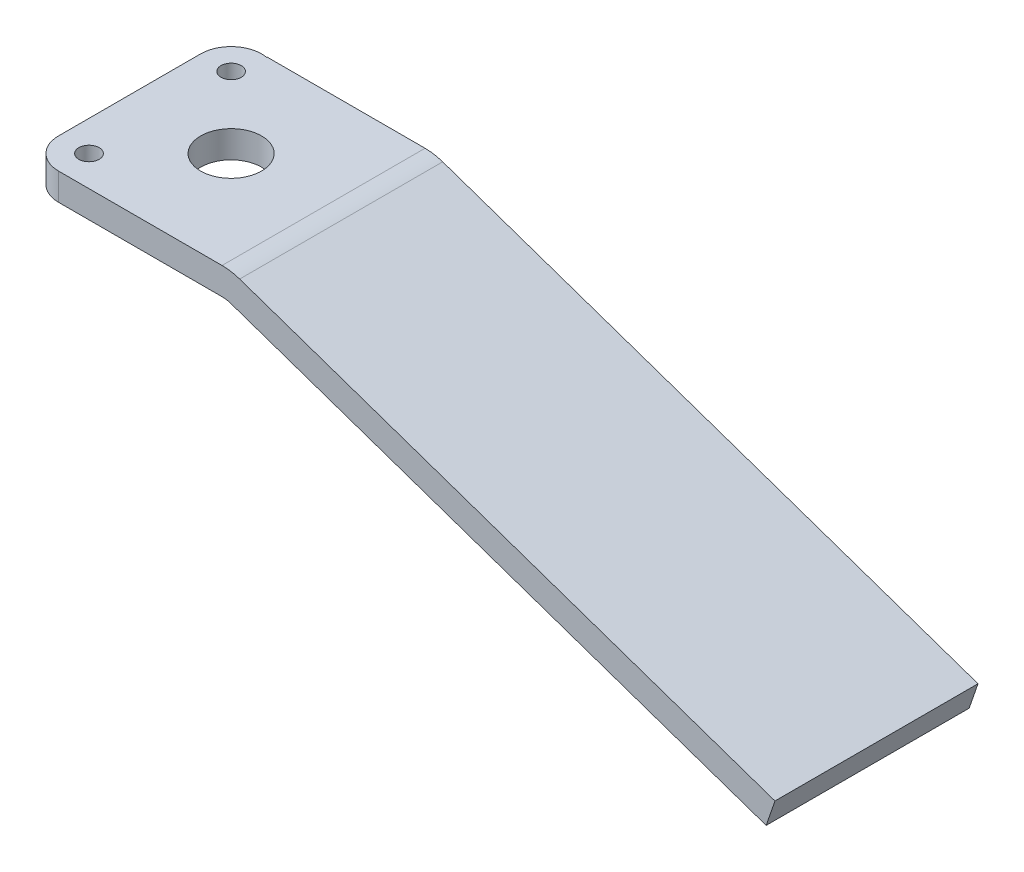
SolidWorks part; units mm, degrees
ref_plane "Plan1" through (0, 0, 0) normal (0, 0, 1) x (1, 0, 0)
ref_plane "Plan2" through (0, 0, 0) normal (0, 1, 0) x (1, 0, 0)
ref_plane "Plan3" through (0, 0, 0) normal (1, 0, 0) x (0, 0, -1)
sketch "Esquisse1" plane through (0, 0, 0) normal (0, 0, 1) x (1, 0, 0)
  line L0 (-14.3306, 0) -> (14.3306, 0)
  line L1 (-14.3306, 0) -> (-14.3306, -4)
  line L2 (14.3306, -4) -> (-14.3306, -4)
  line L4 (15.6329, -4.2179) -> (94.7362, -31.4554)
  line L5 (16.9352, -0.4359) -> (84.9309, -23.8487)
  line L6 (84.9309, -23.8487) -> (96.0384, -27.6733)
  line L7 (96.0384, -27.6733) -> (94.7362, -31.4554)
  arc A0 (15.6329, -4.2179) -> (14.3306, -4) centre (14.3306, -8) ccw
  arc A1 (16.9352, -0.4359) -> (14.3306, 0) centre (14.3306, -8) ccw
  point P12 (15.6694, 0)
  dimension "D4" = 4
  dimension "D5" = 8
  dimension "D1" = 30
  dimension "D2" = 85
  dimension "D3" = 4
  dimension "D6" = 161
extrude "Base-Extrusion" add sketch "Esquisse1" along normal mid plane 30
sketch "Esquisse2" plane through (0, 0, 0) normal (0, 1, 0) x (-1, 0, 0)
  line L0 (14.3306, 15) -> (-14.3306, 15) construction
  line L1 (14.3306, 15) -> (14.3306, -15) construction
  line L2 (14.3306, -15) -> (-14.3306, -15) construction
  circle A0 centre (-0.6694, 0) radius 4.5
  arc A1 (14.3306, 10.5) -> (9.8306, 15) centre (9.8306, 10.5) ccw
  arc A2 (8.901, -14.9029) -> (14.3306, -10.5) centre (9.8306, -10.5) ccw
  circle A3 centre (9.8306, 10.5) radius 1.5
  circle A4 centre (9.8306, -10.5) radius 1.5
  spline_without_curve S0
  spline_without_curve S1
  point P6 (9.5806, 10.6417)
  point P19 (9.5806, -10.6737)
  dimension "D1" = 9
  dimension "D3" = 3
  dimension "D2" = 15
extrude "Enlèv. mat.-Extru.1" cut sketch "Esquisse2" against normal through all
